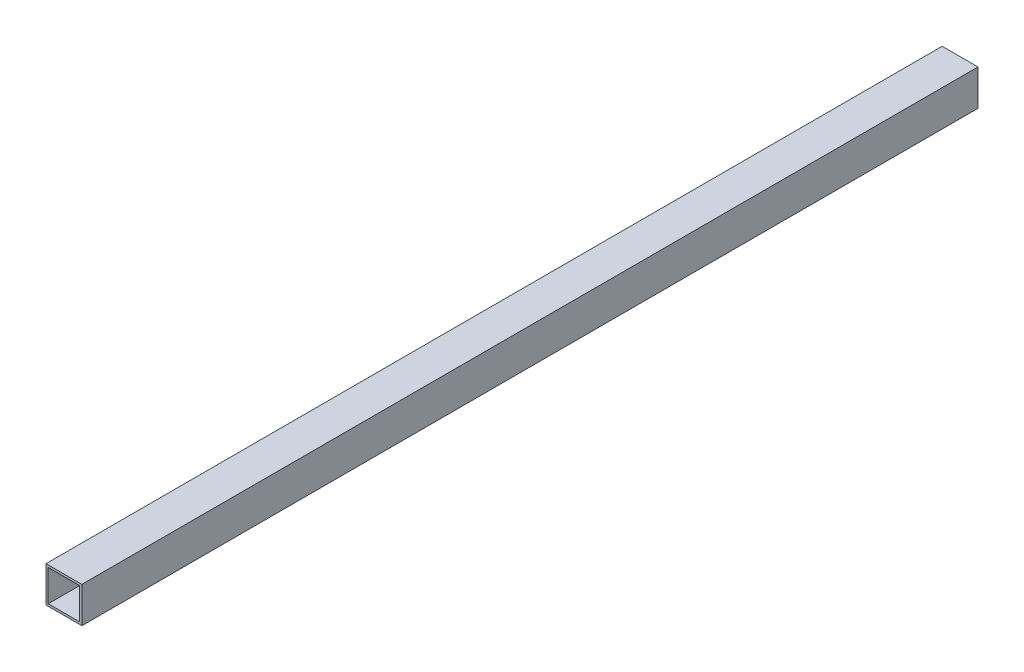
SolidWorks part; units mm, degrees
other "Objet de détail2"
ref_plane "Plan de face" through (0, 0, 0) normal (0, 0, 1) x (1, 0, 0)
ref_plane "Plan de dessus" through (0, 0, 0) normal (0, 1, 0) x (1, 0, 0)
ref_plane "Plan de droite" through (0, 0, 0) normal (1, 0, 0) x (0, 0, -1)
sketch "Esquisse1" plane through (0, 0, 0) normal (0, 0, 1) x (1, 0, 0)
  line L1 (-40, 40) -> (40, 40)
  line L2 (-40, 40) -> (-40, -40)
  line L3 (-40, -40) -> (40, -40)
  line L4 (40, 40) -> (40, -40)
  line L5 (-35, 35) -> (35, 35)
  line L6 (-35, 35) -> (-35, -35)
  line L7 (-35, -35) -> (35, -35)
  line L8 (35, 35) -> (35, -35)
  dimension "D1" = 80
  dimension "D2" = 80
  dimension "D3" = 40
  dimension "D4" = 40
  dimension "D5" = 5
  dimension "D6" = 5
  dimension "D7" = 5
  dimension "D8" = 5
extrude "Boss.-Extru.1" add sketch "Esquisse1" along normal blind 2100
sketch "Esquisse2" plane through (40, 0, 0) normal (1, 0, 0) x (0, 0, -1)
  line L0 (-2000, 596.1929) -> (-2000, -658.8963) construction
  line L1 (0, -40) -> (0, 40) construction
  line L2 (-2000, -40) -> (-2005.175, 63.5008)
  line L3 (-2100, -40) -> (0, -40) construction
  line L4 (-2005.175, 63.5008) -> (-2124.7617, 65.5767)
  line L5 (-2124.7617, 65.5767) -> (-2118.3421, -62.8153)
  line L6 (-2118.3421, -62.8153) -> (-2000, -40)
  dimension "D1" = 2000
  dimension "D2" = 2.862
extrude "Enlèv. mat.-Extru.1" cut sketch "Esquisse2" against normal through all
sketch "Esquisse3" plane through (40, 0, 0) normal (1, 0, 0) x (0, 0, -1)
  line L0 (-2000, -40) -> (-2004, 40) construction
  line L1 (-2000, -40) -> (-2004, 40)
  line L2 (-2004, 40) -> (0, 40) construction
  line L3 (-2004, 40) -> (-2000, 40)
  line L4 (-2000, -40) -> (-2000, 40)
  line L5 (-2000, -40) -> (-2000, 40) construction
extrude "Enlèv. mat.-Extru.2" cut sketch "Esquisse3" against normal through all
